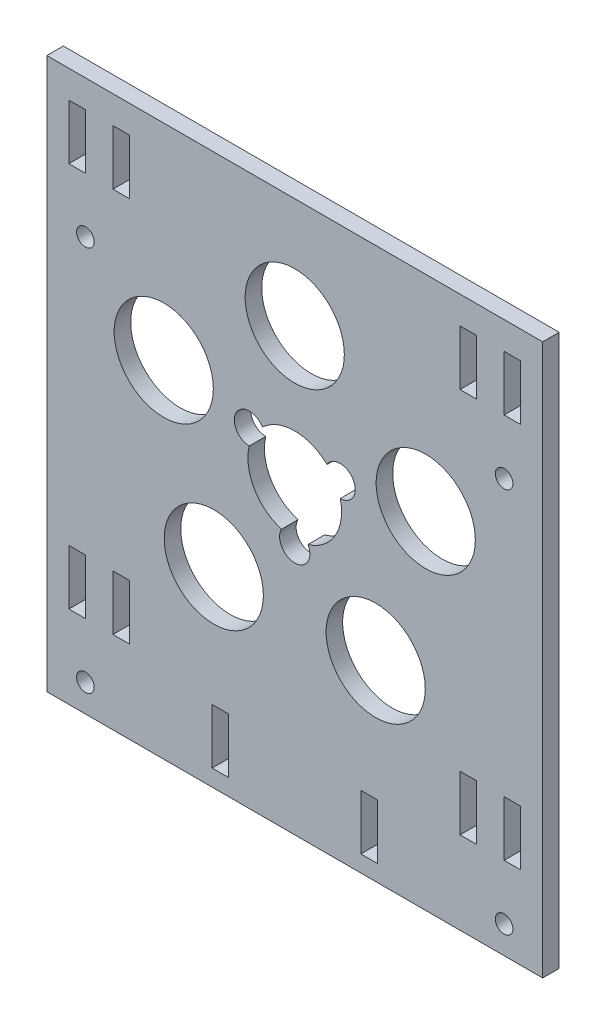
SolidWorks part; units mm, degrees
ref_plane "前视基准面" through (0, 0, 0) normal (0, 0, 1) x (1, 0, 0)
ref_plane "上视基准面" through (0, 0, 0) normal (0, 1, 0) x (1, 0, 0)
ref_plane "右视基准面" through (0, 0, 0) normal (1, 0, 0) x (0, 0, -1)
sketch "草图1" plane through (0, 0, 0) normal (0, 0, 1) x (1, 0, 0)
  line L0 (0, 0) -> (-23.7764, 7.7254) construction
  circle A0 centre (0, 0) radius 12.5
  circle A1 centre (0, 25) radius 12.5
  circle A2 centre (23.7764, 7.7254) radius 12.5
  circle A3 centre (14.6946, -20.2254) radius 12.5
  circle A4 centre (-14.6946, -20.2254) radius 12.5
  circle A5 centre (-23.7764, 7.7254) radius 12.5
  circle A6 centre (-23.7764, 7.7254) radius 10.5
  circle A7 centre (0, 25) radius 10.5
  circle A8 centre (23.7764, 7.7254) radius 10.5
  circle A9 centre (-14.6946, -20.2254) radius 10.5
  circle A10 centre (14.6946, -20.2254) radius 10.5
  circle A11 centre (-23.7764, 7.7254) radius 9
  circle A12 centre (0, 25) radius 9
  circle A13 centre (23.7764, 7.7254) radius 9
  circle A14 centre (14.6946, -20.2254) radius 9
  circle A15 centre (-14.6946, -20.2254) radius 9
  circle A17 centre (0, 0) radius 35.5
  point P16 (0, 0)
  dimension "D1" = 25
  dimension "D2" = 25
  dimension "D4" = 21
  dimension "D5" = 21
  dimension "D6" = 21
  dimension "D7" = 21
  dimension "D8" = 18
  dimension "D11" = 21
  dimension "D3" = 5
  dimension "D10" = 25
  dimension "D9" = 5
sketch "草图2" plane through (0, 0, 0) normal (0, 0, 1) x (1, 0, 0)
  line L0 (-10.5, 25) -> (-10.5, 27.9643)
  line L1 (10.5, 25) -> (10.5, 27.9643)
  line L2 (20.5317, 17.7115) -> (23.3509, 18.6275)
  line L3 (27.0211, -2.2607) -> (29.8403, -1.3447)
  line L4 (23.1893, -14.0537) -> (24.9317, -16.4518)
  line L5 (6.2, -26.3972) -> (7.9423, -28.7953)
  line L6 (-6.2, -26.3972) -> (-7.9423, -28.7953)
  line L7 (-23.1893, -14.0537) -> (-24.9317, -16.4518)
  line L8 (-27.0211, -2.2607) -> (-29.8403, -1.3447)
  line L9 (-20.5317, 17.7115) -> (-23.3509, 18.6275)
  line L11 (0, 0) -> (27.0211, -2.2607) construction
  circle A0 centre (14.6946, -20.2254) radius 10.5 construction
  circle A1 centre (-14.6946, -20.2254) radius 10.5 construction
  circle A2 centre (23.7764, 7.7254) radius 10.5 construction
  circle A3 centre (0, 25) radius 10.5 construction
  circle A4 centre (-23.7764, 7.7254) radius 10.5 construction
  circle A5 centre (0, 0) radius 35.5 construction
  arc A6 (23.1893, -14.0537) -> (6.2, -26.3972) centre (14.6946, -20.2254) ccw
  arc A7 (-6.2, -26.3972) -> (-23.1893, -14.0537) centre (-14.6946, -20.2254) ccw
  arc A8 (20.5317, 17.7115) -> (27.0211, -2.2607) centre (23.7764, 7.7254) ccw
  arc A9 (-10.5, 25) -> (10.5, 25) centre (0, 25) ccw
  arc A10 (-27.0211, -2.2607) -> (-20.5317, 17.7115) centre (-23.7764, 7.7254) ccw
  arc A11 (-16.3413, 31.5153) -> (-24.9231, 25.2802) centre (0, 0) ccw
  arc A12 (-35.0225, -5.8027) -> (-31.7446, -15.8912) centre (0, 0) ccw
  arc A13 (24.9231, 25.2802) -> (16.3413, 31.5153) centre (0, 0) ccw
  arc A14 (31.7446, -15.8912) -> (35.0225, -5.8027) centre (0, 0) ccw
  arc A15 (-5.3039, -35.1016) -> (5.3039, -35.1016) centre (0, 0) ccw
  arc A16 (23.3509, 18.6275) -> (24.9231, 25.2802) centre (22.1148, 22.4318) ccw
  arc A17 (10.5, 27.9643) -> (16.3413, 31.5153) centre (14.5, 27.9643) cw
  arc A18 (-10.5, 27.9643) -> (-16.3413, 31.5153) centre (-14.5, 27.9643) ccw
  arc A19 (-23.3509, 18.6275) -> (-24.9231, 25.2802) centre (-22.1148, 22.4318) cw
  arc A20 (24.9317, -16.4518) -> (31.7446, -15.8912) centre (28.1677, -14.1007) ccw
  arc A21 (7.9423, -28.7953) -> (5.3039, -35.1016) centre (4.7062, -31.1465) cw
  arc A22 (-7.9423, -28.7953) -> (-5.3039, -35.1016) centre (-4.7062, -31.1465) ccw
  arc A23 (-24.9317, -16.4518) -> (-31.7446, -15.8912) centre (-28.1677, -14.1007) cw
  arc A24 (-35.0225, -5.8027) -> (-29.8403, -1.3447) centre (-31.0763, -5.1489) cw
  arc A25 (29.8403, -1.3447) -> (35.0225, -5.8027) centre (31.0763, -5.1489) cw
  dimension "D2" = 4
  dimension "D3" = 4
  dimension "D1" = 5
sketch "草图3" plane through (0, 0, 0) normal (0, 0, 1) x (1, 0, 0)
  line L0 (-45, 45) -> (45, 45)
  line L1 (45, 45) -> (45, -45)
  line L3 (-45, -45) -> (-45, 45)
  line L4 (-45, -45) -> (-45, -55)
  line L7 (-45, -55) -> (45, -55)
  line L8 (45, -45) -> (45, -55)
  dimension "D1" = 90
  dimension "D2" = 90
  dimension "D3" = 10
extrude "凸台-拉伸2" add sketch "草图3" along normal blind 3
sketch "草图4" plane through (0, 0, 3) normal (0, 0, 1) x (1, 0, 0)
  circle A0 centre (0, 0) radius 13.5
sketch "草图5" plane through (0, 0, 3) normal (0, 0, 1) x (1, 0, 0)
  line L0 (-33, 40) -> (-33, 30)
  line L1 (-33, 30) -> (-30, 30)
  line L2 (-30, 30) -> (-30, 40)
  line L3 (-30, 40) -> (-33, 40)
  line L4 (30, 40) -> (30, 30)
  line L5 (30, 30) -> (33, 30)
  line L6 (33, 30) -> (33, 40)
  line L7 (33, 40) -> (30, 40)
  line L8 (-33, -30) -> (-33, -40)
  line L9 (-33, -40) -> (-30, -40)
  line L10 (-30, -40) -> (-30, -30)
  line L11 (-30, -30) -> (-33, -30)
  line L12 (30, -30) -> (30, -40)
  line L13 (30, -40) -> (33, -40)
  line L14 (33, -40) -> (33, -30)
  line L15 (33, -30) -> (30, -30)
  line L16 (0, 45) -> (0, -54.353) construction
  line L17 (-45, 45) -> (45, 45) construction
  line L18 (-45, 0) -> (45, 0) construction
  line L19 (-45, -55) -> (-45, 45) construction
  line L20 (45, -55) -> (45, 45) construction
  dimension "D1" = 3
  dimension "D2" = 10
  dimension "D3" = 10
  dimension "D4" = 3
  dimension "D5" = 10
  dimension "D6" = 3
  dimension "D7" = 3
  dimension "D8" = 10
  dimension "D9" = 30
  dimension "D10" = 30
  dimension "D11" = 30
  dimension "D12" = 30
  dimension "D13" = 30
  dimension "D14" = 30
  dimension "D15" = 30
  dimension "D16" = 30
extrude "切除-拉伸1" cut sketch "草图5" against normal blind 10
sketch "草图6" plane through (0, 0, 3) normal (0, 0, 1) x (1, 0, 0)
  circle A0 centre (23.7764, 7.7254) radius 9 construction
  circle A1 centre (14.6946, -20.2254) radius 9 construction
  circle A2 centre (-14.6946, -20.2254) radius 9 construction
  circle A3 centre (0, 25) radius 9 construction
  circle A4 centre (-23.7764, 7.7254) radius 9 construction
  circle A5 centre (23.7764, 7.7254) radius 9
  circle A11 centre (14.6946, -20.2254) radius 9
  circle A12 centre (-14.6946, -20.2254) radius 9
  circle A13 centre (0, 25) radius 9
  circle A14 centre (-23.7764, 7.7254) radius 9
extrude "切除-拉伸2" cut sketch "草图6" against normal blind 10
sketch "草图7" plane through (0, 0, 3) normal (0, 0, 1) x (1, 0, 0)
  arc A0 (5.8629, 6.1544) -> (-5.8629, 6.1544) centre (0, 0) ccw
  arc A1 (-2.3984, -8.1546) -> (2.3984, -8.1546) centre (0, -9.5) ccw
  arc A2 (-5.8629, 6.1544) -> (-8.2613, 2.0002) centre (-8.2272, 4.75) ccw
  arc A3 (8.2613, 2.0002) -> (5.8629, 6.1544) centre (8.2272, 4.75) ccw
  arc A4 (-8.2613, 2.0002) -> (-2.3984, -8.1546) centre (0, 0) ccw
  arc A5 (2.3984, -8.1546) -> (8.2613, 2.0002) centre (0, 0) ccw
  point P11 (0, 0)
  dimension "D1" = 17
  dimension "D2" = 5.5
  dimension "D3" = 9.5
  dimension "D4" = 3
extrude "切除-拉伸3" cut sketch "草图7" against normal blind 10
sketch "草图8" plane through (0, 0, 3) normal (0, 0, 1) x (1, 0, 0)
  line L0 (0, 45) -> (0, -55) construction
  line L1 (-45, 45) -> (45, 45) construction
  line L2 (-45, -55) -> (45, -55) construction
  line L3 (-15, -42) -> (-12, -42)
  line L4 (-12, -42) -> (-12, -52)
  line L5 (-12, -52) -> (-15, -52)
  line L6 (-15, -52) -> (-15, -42)
  line L7 (-38, -30) -> (-38, -40)
  line L8 (-38, -40) -> (-41, -40)
  line L9 (-41, -30) -> (-38, -30)
  line L10 (-41, -40) -> (-41, -30)
  line L11 (-33, -30) -> (-33, -40) construction
  line L12 (38, -30) -> (38, -40)
  line L13 (38, -40) -> (41, -40)
  line L14 (41, -40) -> (41, -30)
  line L15 (41, -30) -> (38, -30)
  line L16 (38, 40) -> (38, 30)
  line L17 (38, 30) -> (41, 30)
  line L18 (41, 30) -> (41, 40)
  line L19 (41, 40) -> (38, 40)
  line L20 (-38, 40) -> (-38, 30)
  line L21 (-38, 30) -> (-41, 30)
  line L22 (-41, 30) -> (-41, 40)
  line L23 (-41, 40) -> (-38, 40)
  line L24 (33, -40) -> (33, -30) construction
  line L27 (-45, 20) -> (45, 20) construction
  line L28 (-45, -55) -> (-45, 45) construction
  line L29 (45, 45) -> (45, -55) construction
  line L30 (12, -52) -> (15, -52)
  line L31 (12, -42) -> (12, -52)
  line L32 (15, -42) -> (12, -42)
  line L33 (15, -52) -> (15, -42)
  circle A0 centre (-38, -50) radius 1.6
  circle A1 centre (38, -50) radius 1.6
  circle A2 centre (-38, 20) radius 1.6
  circle A3 centre (38, 20) radius 1.6
  dimension "D17" = 3.2
  dimension "D18" = 5
  dimension "D19" = 7
  dimension "D1" = 12
  dimension "D2" = 3
  dimension "D3" = 3
  dimension "D4" = 10
  dimension "D5" = 5
  dimension "D6" = 3
  dimension "D7" = 10
  dimension "D8" = 15
  dimension "D9" = 3
  dimension "D10" = 10
  dimension "D11" = 3
  dimension "D12" = 10
  dimension "D13" = 3
  dimension "D14" = 10
  dimension "D15" = 5
  dimension "D16" = 25
extrude "切除-拉伸4" cut sketch "草图8" against normal blind 10
